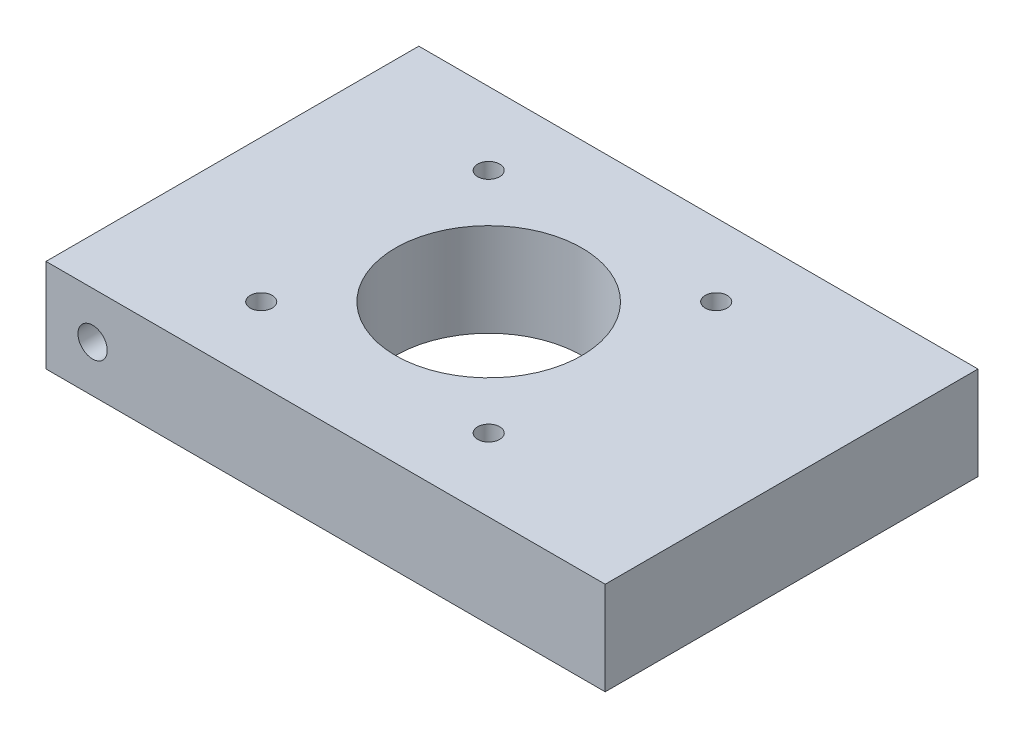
SolidWorks part; units mm, degrees
ref_plane "Front Plane" through (0, 0, 0) normal (0, 0, 1) x (1, 0, 0)
ref_plane "Top Plane" through (0, 0, 0) normal (0, 1, 0) x (1, 0, 0)
ref_plane "Right Plane" through (0, 0, 0) normal (1, 0, 0) x (0, 0, -1)
sketch "Sketch1" plane through (0, 0, 0) normal (0, 1, 0) x (1, 0, 0)
  line L1 (-71.3829, 35.9681) -> (4.8171, 35.9681)
  line L2 (-71.3829, 35.9681) -> (-71.3829, -14.8319)
  line L3 (-71.3829, -14.8319) -> (4.8171, -14.8319)
  line L4 (4.8171, 35.9681) -> (4.8171, -14.8319)
  dimension "D1" = 76.2
  dimension "D2" = 50.8
extrude "Boss-Extrude1" add sketch "Sketch1" along normal blind 12.7
sketch "Sketch2" plane through (0, 12.7, 0) normal (0, 1, 0) x (1, 0, 0)
  line L0 (4.8171, -14.8319) -> (4.8171, 35.9681) construction
  line L1 (4.8171, 35.9681) -> (-71.3829, 35.9681) construction
  circle A0 centre (-36.4579, 10.5681) radius 12.7
  circle A1 centre (-51.9579, 26.0681) radius 1.5
  circle A2 centre (-20.9579, 26.0681) radius 1.5
  circle A3 centre (-20.9579, -4.9319) radius 1.5
  circle A4 centre (-51.9579, -4.9319) radius 1.5
  dimension "D3" = 25.4
  dimension "D4" = 3
  dimension "D1" = 41.275
  dimension "D2" = 25.4
  dimension "D5" = 15.5
  dimension "D6" = 15.5
  dimension "D7" = 4
extrude "Cut-Extrude1" cut sketch "Sketch2" against normal through all
sketch "Sketch3" plane through (0, 0, -35.9681) normal (0, 0, -1) x (-1, 0, 0)
  line L0 (-4.8171, 0) -> (71.3829, 0) construction
  line L1 (71.3829, 12.7) -> (71.3829, 0) construction
  line L2 (-4.8171, 12.7) -> (-4.8171, 0) construction
  circle A0 centre (65.0329, 6.35) radius 2
  circle A1 centre (1.5329, 6.35) radius 2
  dimension "D5" = 4
  dimension "D6" = 4
  dimension "D1" = 6.35
  dimension "D2" = 6.35
  dimension "D3" = 6.35
  dimension "D4" = 6.35
extrude "Cut-Extrude2" cut sketch "Sketch3" against normal through all
sketch "Sketch4" plane through (0, 0, 14.8319) normal (0, 0, 1) x (1, 0, 0)
  circle A0 centre (-1.5329, 6.35) radius 2
extrude "Boss-Extrude2" add sketch "Sketch4" against normal blind 25.4
